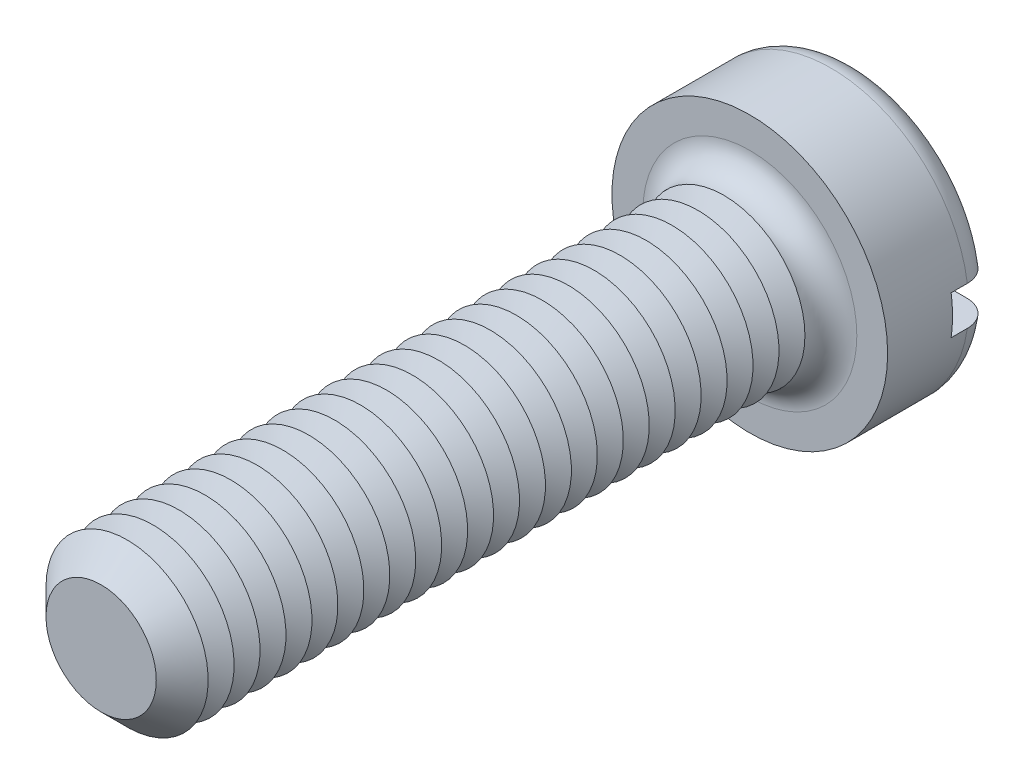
SolidWorks part; units mm, degrees
ref_plane "Front Plane" through (0, 0, 0) normal (0, 0, 1) x (1, 0, 0)
ref_plane "Top Plane" through (0, 0, 0) normal (0, 1, 0) x (1, 0, 0)
ref_plane "Right Plane" through (0, 0, 0) normal (1, 0, 0) x (0, 0, -1)
sketch "Sketch3" plane through (0, 0, 0) normal (0, 0, 1) x (1, 0, 0)
  circle A0 centre (0, 0) radius 4.25
  dimension "D1" = 8.5
extrude "Boss-Extrude2" add sketch "Sketch3" against normal blind 3.3
sketch "Sketch4" plane through (0, 0, 0) normal (0, 0, 1) x (1, 0, 0)
  circle A0 centre (0, 0) radius 2.5
  dimension "D1" = 5
extrude "Boss-Extrude3" add sketch "Sketch4" along normal blind 20
fillet "Fillet1" radius 0.8 2 edges at (4.25, 0, -3.3) (2.5, 0, 0)
chamfer "Chamfer1" distance 0.8 angle 45 1 edges at (2.5, 0, 20)
sketch "Sketch5" plane through (0, 0, 0) normal (1, 0, 0) x (0, 0, -1)
  line L0 (1.6944, 0) -> (-7.6738, 0) construction
sketch "Sketch6" plane through (0, 0, 0) normal (1, 0, 0) x (0, 0, -1)
  line L0 (-0.8, 2.5) -> (-1.2, 1.8072)
  line L1 (-1.2, 1.8072) -> (-1.6, 2.5)
  line L2 (-0.8, 2.5) -> (-19.2, 2.5) construction
  line L3 (-1.6, 2.5) -> (-0.8, 2.5)
  dimension "D1" = 0.8
revolve "Cut-Revolve1" cut sketch "Sketch6" angle 360 about L0
pattern_linear "LPattern1" count 23 spacing 0.8 along (0, 0, 1) of "Cut-Revolve1"
sketch "Sketch8" plane through (0, 0, -3.3) normal (0, 0, -1) x (-1, 0, 0)
  line L1 (4.25, -0.6) -> (-4.25, -0.6)
  line L2 (4.25, -0.6) -> (4.25, 0.6)
  line L3 (4.25, 0.6) -> (-4.25, 0.6)
  line L4 (-4.25, -0.6) -> (-4.25, 0.6)
  line L5 (4.25, -0.6) -> (-4.25, 0.6) construction
  line L6 (4.25, 0.6) -> (-4.25, -0.6) construction
  point P0 (0, 0)
  dimension "D1" = 8.5
  dimension "D2" = 1.2
extrude "Cut-Extrude1" cut sketch "Sketch8" against normal blind 1.3
